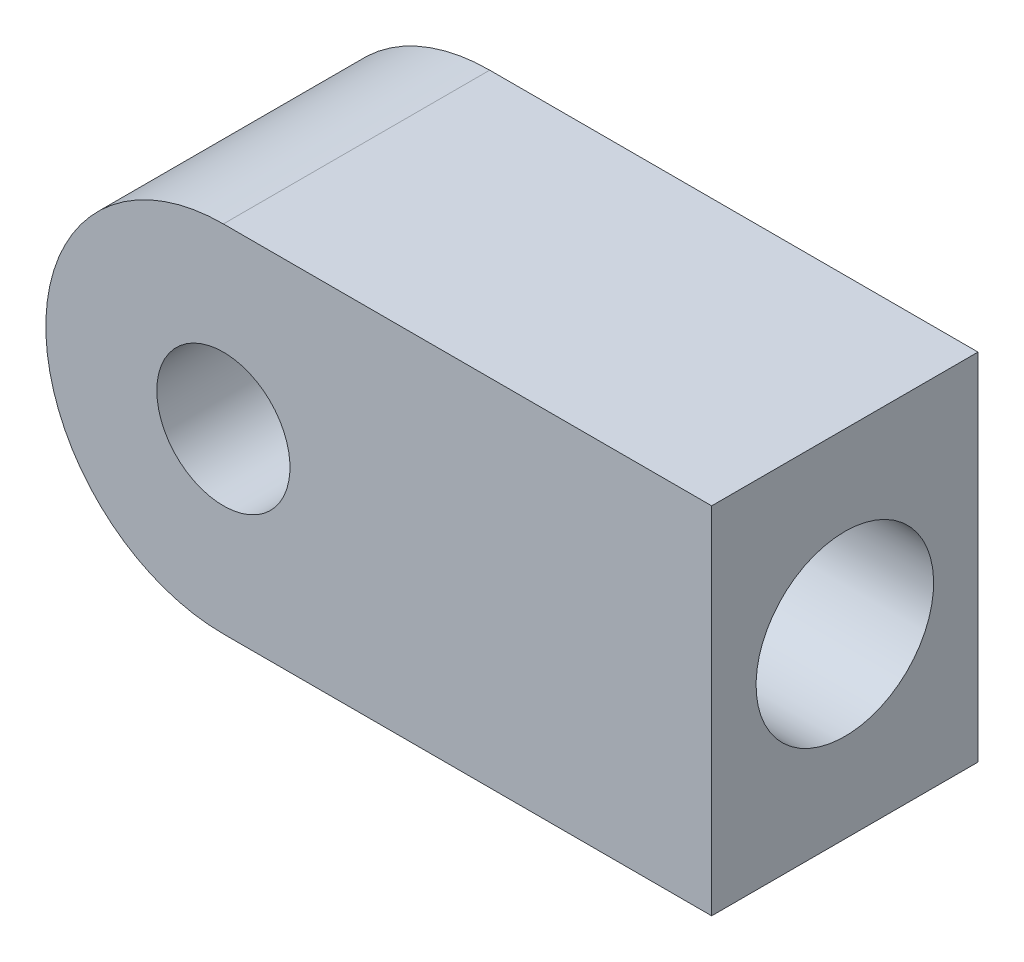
SolidWorks part; units mm, degrees
ref_plane "front" through (0, 0, 0) normal (0, 0, 1) x (1, 0, 0)
ref_plane "top" through (0, 0, 0) normal (0, 1, 0) x (1, 0, 0)
ref_plane "side" through (0, 0, 0) normal (1, 0, 0) x (0, 0, -1)
sketch "Sketch3" plane through (0, 0, 0) normal (0, 0, 1) x (1, 0, 0)
  line L0 (0, 0) -> (-69.85, 0) construction
  line L1 (-69.85, 25.4) -> (0, 25.4)
  line L2 (0, 25.4) -> (0, -25.4)
  line L3 (-69.85, -25.4) -> (0, -25.4)
  arc A0 (-69.85, 25.4) -> (-69.85, -25.4) centre (-69.85, 0) ccw
  circle A1 centre (-69.85, 0) radius 9.525
  point P8 (0, 0)
  dimension "D3" = 19.05
  dimension "D1" = 69.85
  dimension "D2" = 50.8
extrude "Base-Extrude" add sketch "Sketch3" along normal mid plane 38.1
sketch "Sketch4" plane through (0, 0, 0) normal (1, 0, 0) x (0, 0, -1)
  circle A0 centre (0, 0) radius 12.7
  dimension "D1" = 25.4
extrude "Cut-Extrude1" cut sketch "Sketch4" against normal blind 38.1
